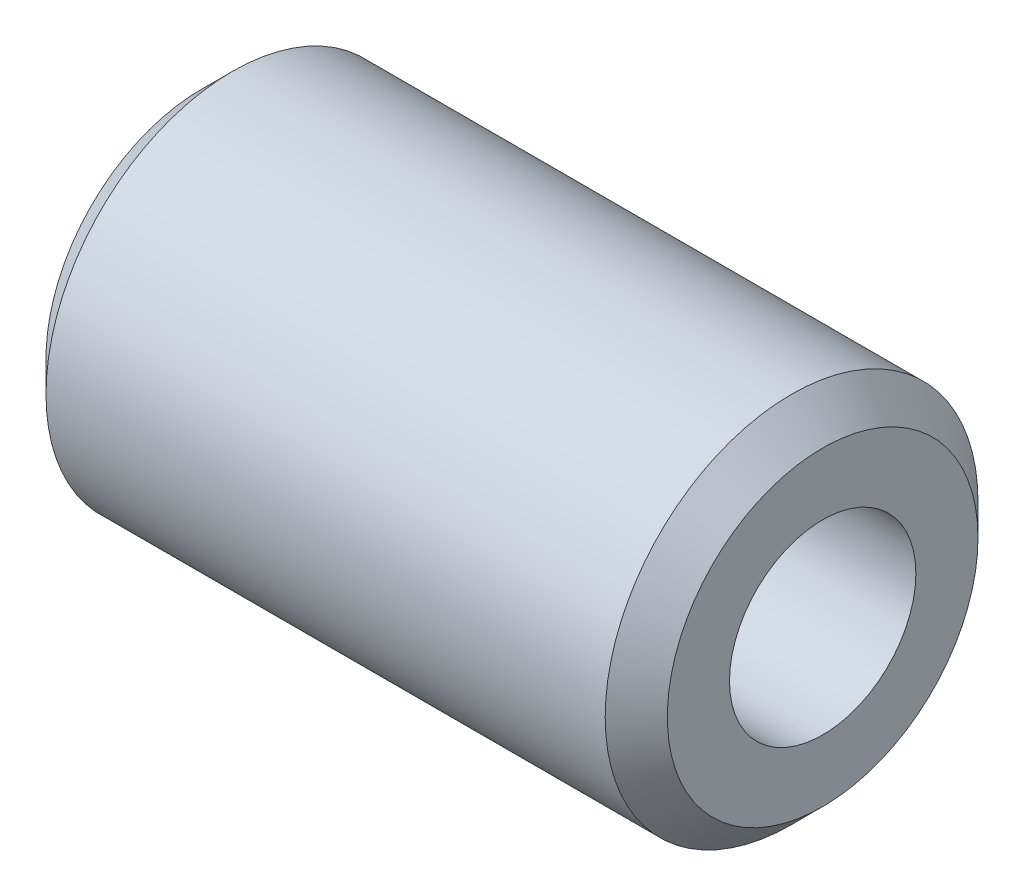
SolidWorks part; units mm, degrees
ref_plane "Face" through (0, 0, 0) normal (0, 0, 1) x (1, 0, 0)
ref_plane "Dessus" through (0, 0, 0) normal (0, 1, 0) x (1, 0, 0)
ref_plane "Droite" through (0, 0, 0) normal (1, 0, 0) x (0, 0, -1)
sketch "Esquisse1" plane through (0, 0, 0) normal (1, 0, 0) x (0, 0, -1)
  circle A0 centre (0, 0) radius 6
extrude "Base-Extrusion" add sketch "Esquisse1" along normal blind 20
chamfer "Chanfrein1" distance 1 angle 45
sketch "Esquisse4" plane through (20, 0, 0) normal (1, 0, 0) x (0, 0, -1)
  circle A0 centre (0, 0) radius 2.5
extrude "Enlèv. mat.-Extru.2" cut sketch "Esquisse4" against normal blind 15
sketch "Esquisse5" plane through (20, 0, 0) normal (1, 0, 0) x (0, 0, -1)
  circle A0 centre (0, 0) radius 3
extrude "Enlèv. mat.-Extru.3" cut sketch "Esquisse5" against normal blind 12
